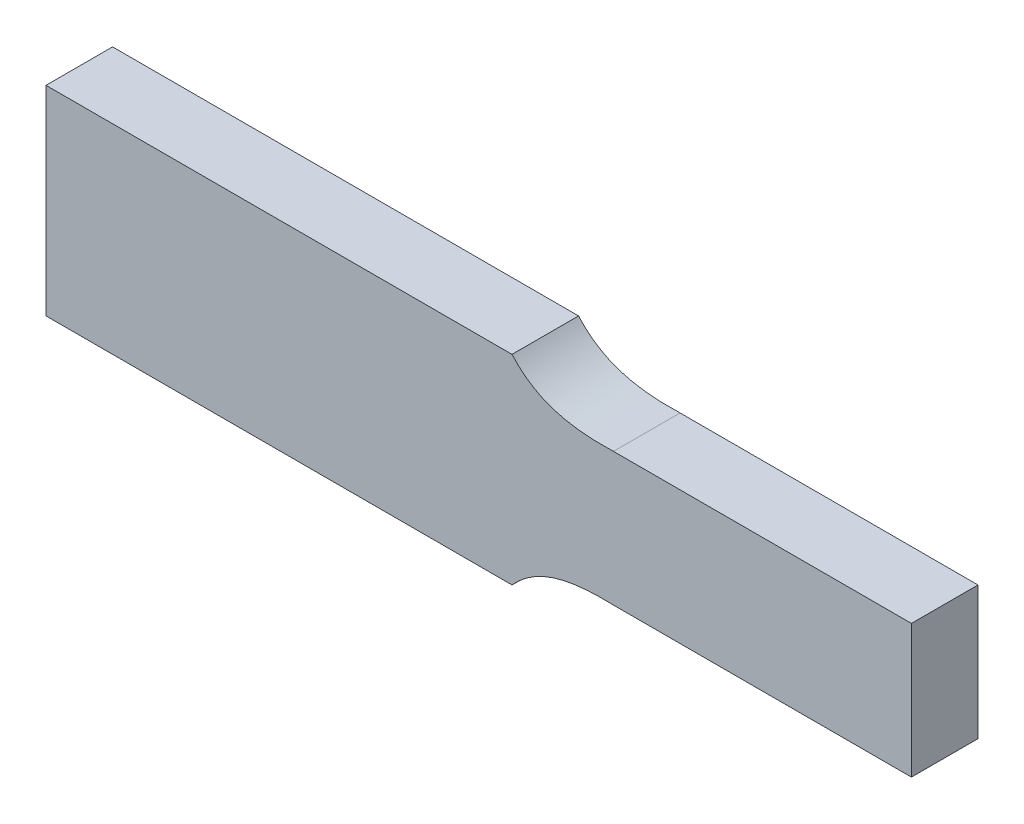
SolidWorks part; units mm, degrees
ref_plane "Ebene vorne" through (0, 0, 0) normal (0, 0, 1) x (1, 0, 0)
ref_plane "Ebene oben" through (0, 0, 0) normal (0, 1, 0) x (1, 0, 0)
ref_plane "Ebene rechts" through (0, 0, 0) normal (1, 0, 0) x (0, 0, -1)
sketch "Skizze1" plane through (0, 0, 0) normal (0, 0, 1) x (1, 0, 0)
  line L0 (0, -18.817) -> (0, 41.183)
  line L1 (0, 41.183) -> (140, 41.183)
  line L2 (170.4898, -8.817) -> (260, -8.817)
  line L3 (170.4898, 31.183) -> (260, 31.183)
  line L4 (260, 31.183) -> (260, -8.817)
  line L7 (140, -18.817) -> (0, -18.817)
  line L8 (0, 11.183) -> (136.9378, 11.183) construction
  spline S0 degree 3 poles (170.4898, 31.183) (162.9877, 30.9453) (151.162, 31.6806) (142.2367, 38.6267) (140, 41.183) knots 0 0 0 0 0.691595 1 1 1 1
  spline S1 degree 3 poles (170.4898, -8.817) (162.9877, -8.5792) (151.162, -9.3146) (142.2367, -16.2607) (140, -18.817) knots 0 0 0 0 0.691595 1 1 1 1
  point P5 (142.5, 38.683)
  point P8 (170.4898, 31.183)
  point P16 (148.0178, 34.933)
  dimension "D2" = 260
  dimension "D3" = 60
  dimension "D4" = 40
extrude "Aufsatz-Linear austragen1" add sketch "Skizze1" along normal blind 20
